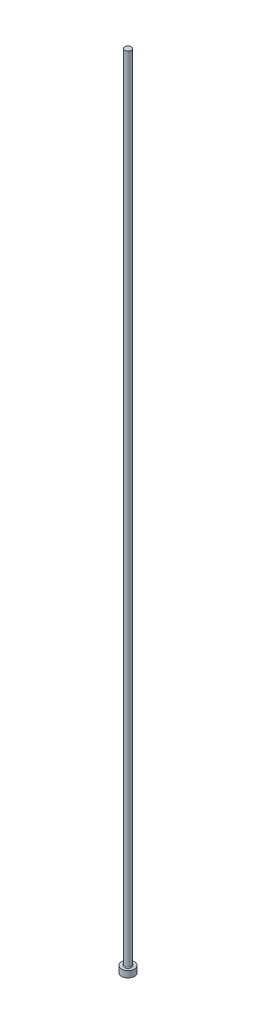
SolidWorks part; units mm, degrees
ref_plane "Plano frontal" through (0, 0, 0) normal (0, 0, 1) x (1, 0, 0)
ref_plane "Plano superior" through (0, 0, 0) normal (0, 1, 0) x (1, 0, 0)
ref_plane "Plano direito" through (0, 0, 0) normal (1, 0, 0) x (0, 0, -1)
sketch "Esboço1" plane through (0, 0, 0) normal (0, 0, 1) x (1, 0, 0)
  line L0 (0, 0) -> (2, 0)
  line L1 (2, 0) -> (2, 2)
  line L2 (2, 2) -> (1.2, 2)
  line L3 (1, 2.2) -> (1, 250)
  line L4 (1, 250) -> (0, 250)
  line L5 (0, 250) -> (0, 0) construction
  line L6 (0, 0) -> (0, 250)
  arc A0 (1.2, 2) -> (1, 2.2) centre (1.2, 2.2) cw
  dimension "D3" = 0.2
  dimension "D1" = 4
  dimension "D2" = 2
  dimension "D4" = 2
  dimension "D5" = 250
revolve "Revolução1" add sketch "Esboço1" angle 360 about L5
sketch "Esboço2"
  dimension "D1" = 1.075
  dimension "D2" = 0.35
  dimension "D3" = 0.225
  dimension "D4" = 0.15
wrap "Envolver1" sketch "Esboço2" wrap type deboss source sketch "Esboço2" thickness 0.1 parameters "D1"=0.1
